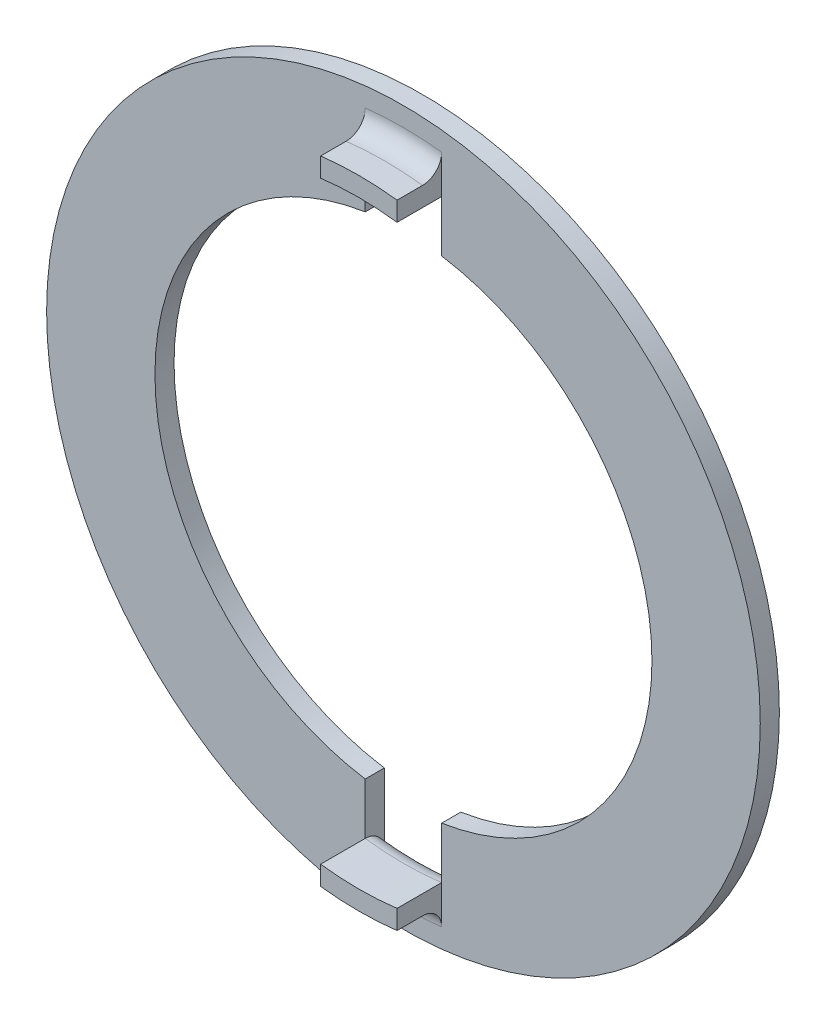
SolidWorks part; units mm, degrees
ref_plane "Plan1" through (0, 0, 0) normal (0, 0, 1) x (1, 0, 0)
ref_plane "Plan2" through (0, 0, 0) normal (0, 1, 0) x (1, 0, 0)
ref_plane "Plan3" through (0, 0, 0) normal (1, 0, 0) x (0, 0, -1)
sketch "Esquisse4" plane through (0, 0, 0) normal (0, 0, 1) x (1, 0, 0)
  circle A0 centre (0, 0) radius 28
  dimension "D1" = 56
extrude "Base-Extrusion" add sketch "Esquisse4" along normal blind 1.5
sketch "Esquisse5" plane through (0, 0, 1.5) normal (0, 0, 1) x (1, 0, 0)
  circle A0 centre (0, 0) radius 19.5
  dimension "D1" = 39
extrude "Enlèv. mat.-Extru.1" cut sketch "Esquisse5" against normal blind 1.5
sketch "Esquisse6" plane through (0, 0, 1.5) normal (0, 0, 1) x (1, 0, 0)
  line L0 (0, 30) -> (0, -30) construction
  line L1 (-40, 0) -> (40, 0) construction
  line L2 (-3, 23.3077) -> (-3, 19.2678)
  line L3 (3, 23.3077) -> (3, 19.2678)
  line L4 (-3, -19.2678) -> (-3, -23.3077)
  line L5 (3, -19.2678) -> (3, -23.3077)
  arc A0 (3, 19.2678) -> (-3, 19.2678) centre (0, 0) ccw
  circle A1 centre (0, 0) radius 19.5 construction
  arc A2 (-3, -23.3077) -> (3, -23.3077) centre (0, 0) ccw
  arc A3 (3, 23.3077) -> (-3, 23.3077) centre (0, 0) ccw
  arc A4 (-3, -19.2678) -> (3, -19.2678) centre (0, 0) ccw
  dimension "D1" = 47
  dimension "D2" = 3
  dimension "D3" = 3
  dimension "D4" = 3
extrude "Enlèv. mat.-Extru.2" cut sketch "Esquisse6" against normal blind 1.5
sketch "Esquisse8" plane through (0, 0, 1.5) normal (0, 0, 1) x (1, 0, 0)
  line L1 (-3, 24.8193) -> (-3, 23.3077)
  line L2 (3, 24.8193) -> (3, 23.3077)
  line L3 (3, -23.3077) -> (3, -24.8193)
  line L4 (-3, -23.3077) -> (-3, -24.8193)
  arc A0 (-3, -23.3077) -> (3, -23.3077) centre (0, 0) ccw
  arc A2 (-3, -24.8193) -> (3, -24.8193) centre (0, 0) ccw
  arc A3 (3, 24.8193) -> (-3, 24.8193) centre (0, 0) ccw
  arc A4 (3, 23.3077) -> (-3, 23.3077) centre (0, 0) ccw
  dimension "D1" = 47
  dimension "D2" = 50
extrude "Boss.-Extru.2" add sketch "Esquisse8" along normal blind 3.5
fillet "Congé1" radius 1.5
